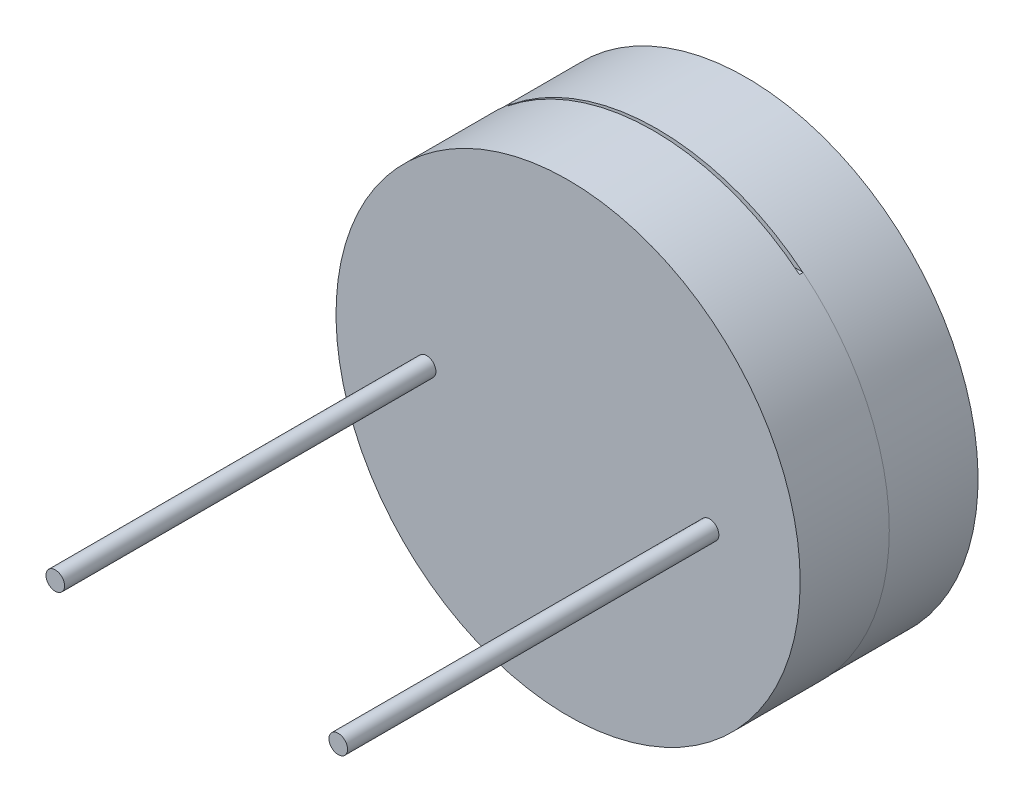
SolidWorks part; units mm, degrees
ref_plane "Plan de face" through (0, 0, 0) normal (0, 0, 1) x (1, 0, 0)
ref_plane "Plan de dessus" through (0, 0, 0) normal (0, 1, 0) x (1, 0, 0)
ref_plane "Plan de droite" through (0, 0, 0) normal (1, 0, 0) x (0, 0, -1)
sketch "Esquisse1" plane through (0, 0, 0) normal (0, 0, 1) x (1, 0, 0)
  circle A0 centre (0, 0) radius 6.25
  dimension "D1" = 12.5
extrude "Extrusion1" add sketch "Esquisse1" along normal blind 2.4
sketch "Esquisse3" plane through (0, 0, 0) normal (0, 0, -1) x (-1, 0, 0)
  line L0 (3.5667, 4.8584) -> (3.9317, 4.8584)
  line L1 (0, 0) -> (7.1, 0) construction
  line L2 (-3.9317, -4.8584) -> (3.3667, -4.8584)
  line L3 (3.3667, 4.8584) -> (3.3667, 4.0584)
  line L4 (3.3667, 4.0584) -> (-3.2333, 4.0584)
  line L5 (-3.2333, 4.0584) -> (-3.2333, 3.1473)
  line L6 (-3.2333, 3.1473) -> (3.3667, 3.1473)
  line L7 (3.3667, 2.2473) -> (3.3667, 3.1473)
  line L8 (3.3667, 2.2473) -> (-3.2333, 2.2473)
  line L9 (-3.2333, 1.3473) -> (-3.2333, 2.2473)
  line L10 (-3.2333, 1.3473) -> (3.3667, 1.3473)
  line L11 (3.3667, 0.4473) -> (3.3667, 1.3473)
  line L12 (3.3667, 0.4473) -> (-3.2333, 0.4473)
  line L13 (-3.0333, 0.2473) -> (-3.0333, -0.2473)
  line L14 (3.5667, 4.8584) -> (3.5667, 3.8584)
  line L15 (3.5667, 3.8584) -> (-3.0333, 3.8584)
  line L16 (-3.0333, 3.8584) -> (-3.0333, 3.3473)
  line L17 (-3.0333, 3.3473) -> (3.5667, 3.3473)
  line L18 (3.5667, 2.0473) -> (3.5667, 3.3473)
  line L19 (3.5667, 2.0473) -> (-3.0333, 2.0473)
  line L20 (-3.0333, 1.5473) -> (-3.0333, 2.0473)
  line L21 (-3.0333, 1.5473) -> (3.5667, 1.5473)
  line L22 (3.5667, 0.2473) -> (3.5667, 1.5473)
  line L23 (3.5667, 0.2473) -> (-3.0333, 0.2473)
  line L24 (-3.2333, 0.4473) -> (-3.2333, -0.4473)
  line L25 (3.9317, 4.8584) -> (3.9176, 4.8488)
  line L26 (-3.9317, 4.8584) -> (3.3667, 4.8584)
  line L27 (3.9317, -4.8584) -> (3.9176, -4.8488)
  line L29 (3.5667, -0.2473) -> (-3.0333, -0.2473)
  line L30 (3.5667, -1.5473) -> (3.5667, -0.2473)
  line L31 (-3.0333, -1.5473) -> (3.5667, -1.5473)
  line L32 (-3.0333, -2.0473) -> (-3.0333, -1.5473)
  line L33 (3.5667, -2.0473) -> (-3.0333, -2.0473)
  line L34 (3.5667, -3.3473) -> (3.5667, -2.0473)
  line L35 (-3.0333, -3.3473) -> (3.5667, -3.3473)
  line L36 (-3.0333, -3.8584) -> (-3.0333, -3.3473)
  line L37 (3.5667, -3.8584) -> (-3.0333, -3.8584)
  line L38 (3.5667, -4.8584) -> (3.5667, -3.8584)
  line L40 (3.3667, -0.4473) -> (-3.2333, -0.4473)
  line L41 (3.3667, -1.3473) -> (3.3667, -0.4473)
  line L42 (-3.2333, -1.3473) -> (3.3667, -1.3473)
  line L43 (-3.2333, -2.2473) -> (-3.2333, -1.3473)
  line L44 (3.3667, -2.2473) -> (-3.2333, -2.2473)
  line L45 (3.3667, -3.1473) -> (3.3667, -2.2473)
  line L46 (-3.2333, -3.1473) -> (3.3667, -3.1473)
  line L47 (-3.2333, -4.0584) -> (-3.2333, -3.1473)
  line L48 (3.3667, -4.0584) -> (-3.2333, -4.0584)
  line L49 (3.3667, -4.8584) -> (3.3667, -4.0584)
  line L50 (3.5667, -4.8584) -> (3.9317, -4.8584)
  line L51 (3.3667, 1.3473) -> (3.3667, 0.4473) construction
  line L52 (3.3667, 3.1473) -> (3.3667, 2.2473) construction
  line L53 (-3.2333, 0.4473) -> (-3.2333, -0.0027) construction
  line L54 (-3.2333, 2.2473) -> (-3.2333, 1.3473) construction
  line L55 (3.5667, 1.5473) -> (3.5667, 0.2473) construction
  line L56 (3.5667, 3.3473) -> (3.5667, 2.0473) construction
  line L57 (-3.0333, 0.2473) -> (-3.0333, -0.0027) construction
  line L58 (-3.0333, 2.0473) -> (-3.0333, 1.5473) construction
  line L59 (3.9317, 4.8584) -> (4.6139, 6.3222)
  line L60 (4.6139, 6.3222) -> (-2.0306, 6.7)
  line L61 (-2.0306, 6.7) -> (-5.1639, 6.0778)
  line L62 (-5.1639, 6.0778) -> (-3.9317, 4.8584)
  line L63 (-3.9317, 4.8584) -> (-3.9417, 4.8556)
  line L64 (3.9176, -4.8488) -> (4.4361, -5.6111)
  line L65 (4.4361, -5.6111) -> (1.1317, -6.7438)
  line L66 (1.1317, -6.7438) -> (-3.475, -6.4778)
  line L67 (-3.475, -6.4778) -> (-3.9317, -4.8584)
  circle A0 centre (0, 0) radius 6.25 construction
  dimension "D1" = 0.9
  dimension "D2" = 0.9
  dimension "D3" = 0.9
  dimension "D4" = 0.8
  dimension "D6" = 0.2
sketch "Esquisse2" plane through (0, 0, 0) normal (0, 0, -1) x (-1, 0, 0)
  circle A0 centre (0, 0) radius 6.24
extrude "Enlèv. mat.-Extru.1" cut sketch "Esquisse3" against normal blind 0.1 contours L64 L50 L38 L37 L36 L35 L34 L33 L32 L31 L30 L29 L13 L23 L22 L21 L20 L19 L18 L17 L16 L15 L14 L0 L26 L3 L4 L5 L6 L7 L8 L9 L10 L11 L12 L24 L40 L41 L42 L43 L44 L45 L46 L47 L48 L49 L2 M1
extrude "Extrusion4" add sketch "Esquisse2" along normal blind 2.4
sketch "Esquisse4" plane through (0, 0, 2.4) normal (0, 0, 1) x (1, 0, 0)
  line L0 (-5.7, 0) -> (5.5667, 0) construction
  line L1 (0, 0) -> (0, 2.7222) construction
  circle A0 centre (3.81, 0) radius 0.25
  circle A1 centre (-3.81, 0) radius 0.25
  dimension "D1" = 0.5
  dimension "D2" = 3.81
extrude "Extrusion5" add sketch "Esquisse4" along normal blind 10
